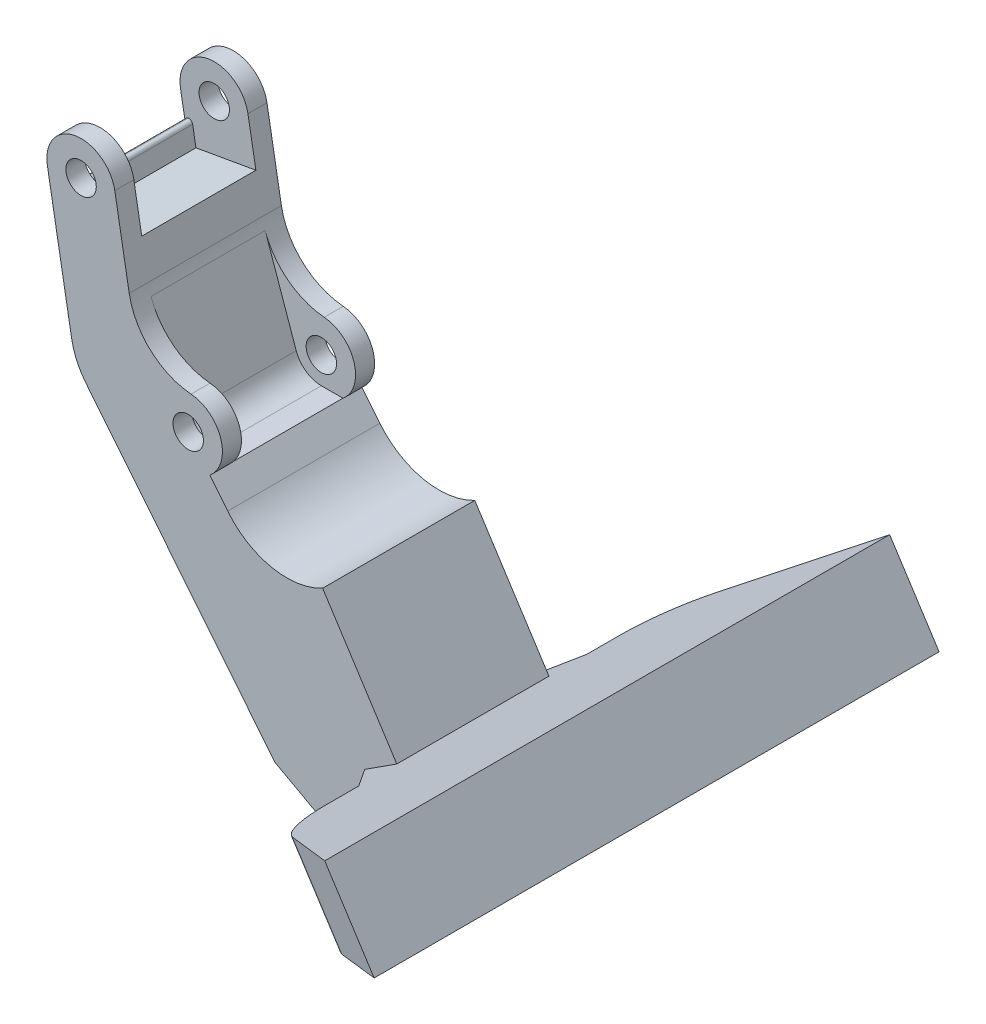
SolidWorks part; units mm, degrees
ref_plane "前视基准面" through (0, 0, 0) normal (0, 0, 1) x (1, 0, 0)
ref_plane "上视基准面" through (0, 0, 0) normal (0, 1, 0) x (1, 0, 0)
ref_plane "右视基准面" through (0, 0, 0) normal (1, 0, 0) x (0, 0, -1)
sketch "草图1" plane through (0, 0, 0) normal (0, 0, 1) x (1, 0, 0)
  line L0 (0, 0) -> (14, 0)
  line L1 (0, 0) -> (-4.51, 25.5772)
  line L2 (7.5519, 9) -> (14, 9)
  line L3 (7.5519, 9) -> (4.3533, 27.1401)
  line L4 (7.5519, 9) -> (14, 9) construction
  line L5 (7.5519, 9) -> (4.3533, 27.1401) construction
  line L6 (-0.0783, 26.3587) -> (14, 4.5) construction
  arc A0 (4.3533, 27.1401) -> (-4.51, 25.5772) centre (-0.0783, 26.3587) ccw
  arc A1 (14, 0) -> (14, 9) centre (14, 4.5) ccw
  dimension "D1" = 9
  dimension "D2" = 9
  dimension "D6" = 26
  dimension "D3" = 14
  dimension "D5" = 100
  dimension "D4" = 9
extrude "凸台-拉伸1" add sketch "草图1" along normal mid plane 20
fillet "圆角1" radius 9 2 edges at (7.5519, 9, 0) (0, 0, 0)
sketch "草图2" plane through (0, 0, 0) normal (0, 0, 1) x (1, 0, 0)
  line L0 (-4.0163, 28.5363) -> (-2.4833, 19.842)
  line L1 (-4.51, 25.5772) -> (-1.3114, 7.4372) construction
  line L4 (-2.4833, 19.842) -> (5.3952, 21.2312)
  line L9 (-4.51, 25.5772) -> (-1.3114, 7.4372)
  line L10 (7.5519, 0) -> (14, 0)
  line L11 (6.2486, 16.3913) -> (4.3533, 27.1401)
  line L14 (5.3952, 21.2312) -> (4.3533, 27.1401)
  arc A5 (-1.3114, 7.4372) -> (7.5519, 0) centre (7.5519, 9) ccw
  arc A6 (14, 0) -> (14.3706, 8.9847) centre (14, 4.5) ccw
  arc A7 (6.2486, 16.3913) -> (14.3706, 8.9847) centre (15.1119, 17.9541) ccw
  arc A8 (4.3533, 27.1401) -> (-4.51, 25.5772) centre (-0.0783, 26.3587) ccw
  arc A12 (4.3533, 27.1401) -> (-4.0163, 28.5363) centre (-0.0783, 26.3587) ccw
  dimension "D1" = 1
  dimension "D3" = 0
  dimension "D2" = 6
extrude "切除-拉伸1" cut sketch "草图2" against normal mid plane 15
sketch "草图3" plane through (0, 0, 0) normal (0, 0, 1) x (1, 0, 0)
  line L0 (10.6971, 3.3422) -> (6.6186, 14.9769)
  line L1 (14, 1) -> (16.8284, 1)
  line L3 (-4.51, 25.5772) -> (-1.3114, 7.4372)
  line L4 (7.5519, 0) -> (14, 0)
  line L5 (6.2486, 16.3913) -> (4.3533, 27.1401)
  arc A0 (10.6971, 3.3422) -> (14, 1) centre (14, 4.5) ccw
  arc A4 (-1.3114, 7.4372) -> (7.5519, 0) centre (7.5519, 9) ccw
  arc A5 (14, 0) -> (14.3706, 8.9847) centre (14, 4.5) ccw
  arc A6 (6.2486, 16.3913) -> (14.3706, 8.9847) centre (15.1119, 17.9541) ccw
  arc A7 (4.3533, 27.1401) -> (-4.51, 25.5772) centre (-0.0783, 26.3587) ccw
  arc A9 (16.8284, 1) -> (14.3706, 8.9847) centre (14, 4.5) ccw
  arc A10 (6.6186, 14.9769) -> (14.3706, 8.9847) centre (15.1119, 17.9541) ccw
  dimension "D2" = 7
  dimension "D1" = 0
extrude "切除-拉伸2" cut sketch "草图3" against normal mid plane 15
sketch "草图4" plane through (0, 0, 0) normal (0, 0, 1) x (1, 0, 0)
  line L0 (14, 4.5) -> (16.8284, 1) construction
  line L1 (34.1133, -20.3889) -> (25.4124, -27.4202)
  line L2 (0.5519, 3.3431) -> (25.4124, -27.4202)
  line L3 (16.8284, 1) -> (34.1133, -20.3889)
  line L5 (14, 0) -> (7.5519, 0)
  arc A0 (-1.3114, 7.4372) -> (7.5519, 0) centre (7.5519, 9) ccw construction
  arc A1 (0.5519, 3.3431) -> (7.5519, 0) centre (7.5519, 9) ccw
  arc A2 (14, 0) -> (14, 9) centre (14, 4.5) ccw construction
  arc A3 (14, 0) -> (16.8284, 1) centre (14, 4.5) ccw
  dimension "D1" = 90
  dimension "D2" = 32
extrude "凸台-拉伸2" add sketch "草图4" along normal mid plane 20
sketch "草图6" plane through (0, 0, 10) normal (0, 0, 1) x (1, 0, 0)
  line L0 (14, 4.5) -> (39.5027, -35.0967) construction
  line L1 (-0.0783, 26.3587) -> (14, 4.5) construction
  line L2 (23.2585, -9.8752) -> (39.5027, -35.0967)
  line L3 (23.2585, -9.8752) -> (31.6657, -4.4604)
  line L4 (39.5027, -35.0967) -> (47.9099, -29.6819)
  line L5 (31.6657, -4.4604) -> (47.9099, -29.6819)
  line L6 (25.4124, -27.4202) -> (34.1133, -20.3889) construction
  line L7 (25.4124, -27.4202) -> (39.5027, -35.0967)
  line L8 (25.4124, -27.4202) -> (31.3806, -22.4859)
  dimension "D1" = 10
  dimension "D2" = 15
  dimension "D3" = 30
extrude "凸台-拉伸3" add sketch "草图6" against normal blind 20 contours L7 L2 M14 | L5 L3 L2 L4 M6 M14
sketch "草图7" plane through (20.351, 13.1073, 0) normal (0.8407, 0.5415, 0) x (0, 0, -1)
  line L0 (10, -50.8961) -> (-10, -50.8961) construction
  line L1 (25, -38.8961) -> (-25, -38.8961)
  line L2 (25, -38.8961) -> (25, -50.8961)
  line L3 (25, -50.8961) -> (-25, -50.8961)
  line L4 (-25, -38.8961) -> (-25, -50.8961)
  line L5 (25, -38.8961) -> (-25, -50.8961) construction
  line L6 (25, -50.8961) -> (-25, -38.8961) construction
  line L7 (0, -44.8961) -> (0, 0) construction
  point P0 (0, -44.8961)
  dimension "D1" = 12
  dimension "D2" = 50
extrude "凸台-拉伸4" add sketch "草图7" along normal blind 21
sketch "草图8" plane through (21.0612, -32.7006, 0) normal (-0.5415, 0.8407, 0) x (0.8407, 0.5415, 0)
  line L0 (24.2067, 25) -> (45.2067, 37.1244)
  line L1 (45.2067, 37.1244) -> (45.2067, 25)
  line L2 (45.2067, 25) -> (24.2067, 25)
  line L3 (0, 0) -> (-58.7505, 0) construction
  line L4 (45.2067, -25) -> (24.2067, -25)
  line L5 (45.2067, -37.1244) -> (45.2067, -25)
  line L6 (24.2067, -25) -> (45.2067, -37.1244)
  dimension "D1" = 60
extrude "凸台-拉伸5" add sketch "草图8" against normal up to surface (12 mm away)
fillet "圆角2" radius 10 3 edges at (44.661, -24.6376, -25) (44.661, -24.6376, 25) (24.8096, -8.8762, 0)
chamfer "倒角1" distance 5 angle 45 2 edges at (44.661, -24.6376, -10) (44.661, -24.6376, 10)
sketch "草图10" plane through (0.9848, 0.1736, 0) normal (0.9848, 0.1736, 0) x (0, 0, -1)
  line L0 (-7.5, 28.8002) -> (-7.5, 25.9718)
  line L2 (7.5, 25.9718) -> (7.5, 28.8002)
  line L3 (7.5, 28.8002) -> (-7.5, 28.8002)
  line L4 (-7.5, 25.9718) -> (-7.5, 22.9718)
  line L5 (-7.5, 19.9718) -> (-7.5, 25.9718) construction
  line L6 (-7.5, 22.9718) -> (7.5, 22.9718)
  line L7 (7.5, 19.9718) -> (7.5, 25.9718) construction
  line L8 (7.5, 22.9718) -> (7.5, 25.9718)
extrude "切除-拉伸3" cut sketch "草图10" against normal blind 10
sketch "草图11" plane through (0, 0, 10) normal (0, 0, 1) x (1, 0, 0)
  circle A0 centre (-0.0783, 26.3587) radius 2
  dimension "D1" = 4
extrude "切除-拉伸4" cut sketch "草图11" against normal through all
sketch "草图12" plane through (0, 0, -7.5) normal (0, 0, 1) x (1, 0, 0)
  circle A0 centre (14, 4.5) radius 2
  dimension "D1" = 4
extrude "切除-拉伸5" cut sketch "草图12" against normal through all both and the other way through all
fillet "圆角3" radius 0.5 2 edges at (-3.0042, 22.7965, 0) (-3.989, 22.6228, 0)
